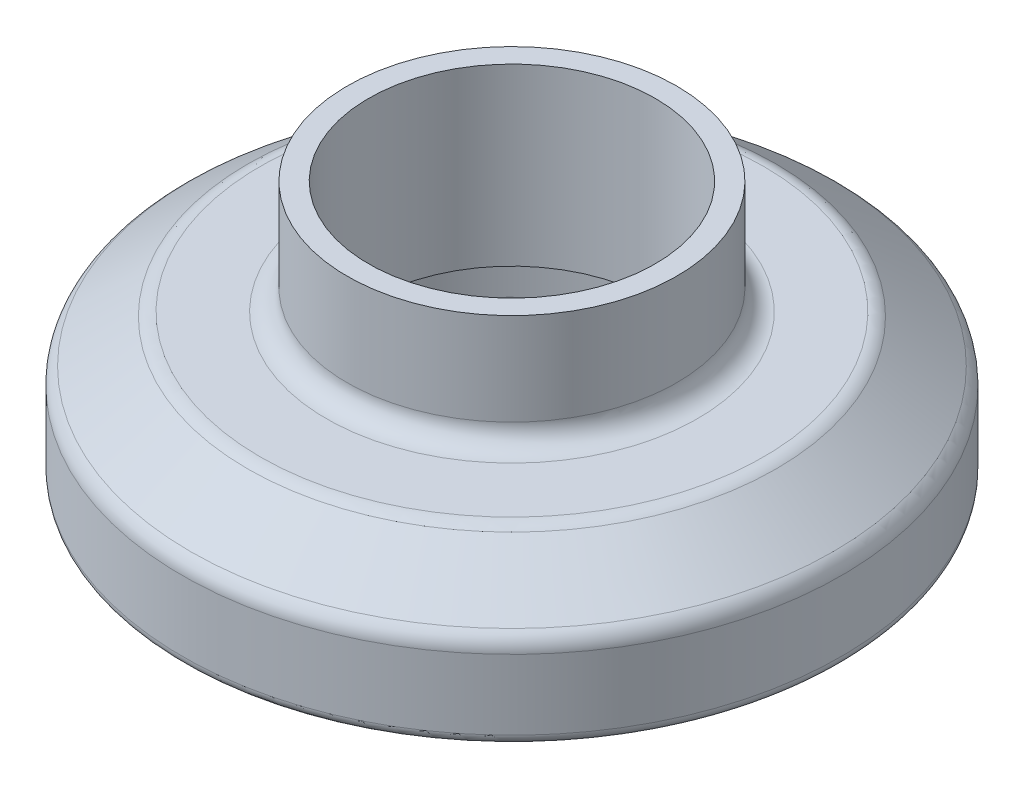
SolidWorks part; units mm, degrees
ref_plane "Front Plane" through (0, 0, 0) normal (0, 0, 1) x (1, 0, 0)
ref_plane "Top Plane" through (0, 0, 0) normal (0, 1, 0) x (1, 0, 0)
ref_plane "Right Plane" through (0, 0, 0) normal (1, 0, 0) x (0, 0, -1)
sketch "Sketch1" plane through (0, 0, 0) normal (0, 0, 1) x (1, 0, 0)
  line L0 (-11.049, 19.8374) -> (-12.7, 19.8374)
  line L1 (-12.7, 19.8374) -> (-12.7, 12.7254)
  line L2 (-14.3002, 11.1252) -> (-19.3967, 11.1252)
  line L3 (-20.3598, 10.803) -> (-24.7628, 7.485)
  line L4 (-25.4, 6.207) -> (-25.4, 0.8128)
  line L5 (-24.5872, 0) -> (-16.764, 0)
  line L6 (-15.9512, 0.8128) -> (-15.9512, 5.5372)
  line L7 (-15.1384, 6.35) -> (-11.049, 6.35)
  line L8 (-11.049, 6.35) -> (-11.049, 19.8374)
  line L9 (0, 0) -> (0, 40.2749) construction
  arc A0 (-14.3002, 11.1252) -> (-12.7, 12.7254) centre (-14.3002, 12.7254) ccw
  arc A1 (-20.3598, 10.803) -> (-19.3967, 11.1252) centre (-19.3967, 9.525) cw
  arc A2 (-25.4, 6.207) -> (-24.7628, 7.485) centre (-23.7998, 6.207) cw
  arc A3 (-25.4, 0.8128) -> (-24.5872, 0) centre (-24.5872, 0.8128) ccw
  arc A4 (-15.1384, 6.35) -> (-15.9512, 5.5372) centre (-15.1384, 5.5372) ccw
  arc A5 (-15.9512, 0.8128) -> (-16.764, 0) centre (-16.764, 0.8128) cw
  point P2 (-22.5613, 9.144)
  point P15 (-19.9321, 11.1252)
  point P20 (-25.4, 0)
  point P23 (-15.9512, 6.35)
  point P26 (-15.9512, 0)
  dimension "D10" = 1.6002
  dimension "D11" = 1.6002
  dimension "D12" = 1.6002
  dimension "D13" = 0.8128
  dimension "D14" = 0.8128
  dimension "D1" = 11.049
  dimension "D2" = 12.7
  dimension "D3" = 15.9512
  dimension "D4" = 25.4
  dimension "D5" = 11.1252
  dimension "D6" = 19.8374
  dimension "D7" = 6.35
  dimension "D8" = 53
  dimension "D9" = 9.144
revolve "Revolve1" add sketch "Sketch1" angle 360 about L9
